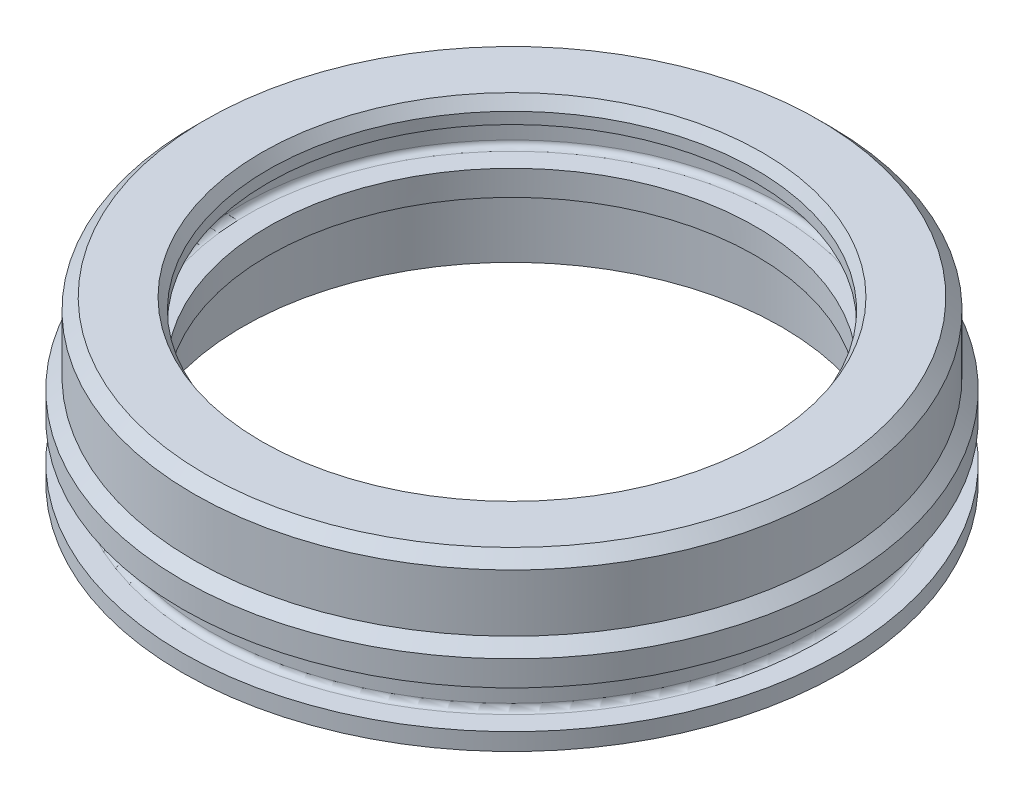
SolidWorks part; units mm, degrees
ref_plane "Face" through (0, 0, 0) normal (0, 0, 1) x (1, 0, 0)
ref_plane "Dessus" through (0, 0, 0) normal (0, 1, 0) x (1, 0, 0)
ref_plane "Droite" through (0, 0, 0) normal (1, 0, 0) x (0, 0, -1)
sketch "Esquisse1" plane through (0, 0, 0) normal (0, 0, 1) x (1, 0, 0)
  line L0 (0, 0) -> (-57.5, 0)
  line L1 (-57.5, 0) -> (-57.5, 14)
  line L2 (-57.5, 14) -> (-55.5, 16)
  line L3 (-55.5, 16) -> (-55.5, 28)
  line L4 (-55.5, 28) -> (0, 28)
  line L5 (0, 28) -> (0, 0)
  line L6 (0, 0) -> (0, -34.0519) construction
  dimension "D1" = 14
  dimension "D2" = 45
  dimension "D3" = 28
  dimension "D4" = 57.5
  dimension "D5" = 55.5
revolve "Révolution1" add sketch "Esquisse1" angle 360 about L6
chamfer "Chanfrein1" distance 2 angle 45 1 edges at (0, 28, 55.5)
sketch "Esquisse2" plane through (0, 28, 0) normal (0, 1, 0) x (-1, 0, 0)
  circle A0 centre (0, 0) radius 42.5
  circle A1 centre (0, 0) radius 55.5 construction
  dimension "D1" = 85
extrude "Enlèv. mat.-Extru.1" cut sketch "Esquisse2" against normal up to next
sketch "Esquisse3" plane through (0, 0, 0) normal (0, -1, 0) x (1, 0, 0)
  circle A0 centre (0, 0) radius 47
  circle A1 centre (0, 0) radius 57.5 construction
  dimension "D1" = 94
extrude "Enlèv. mat.-Extru.2" cut sketch "Esquisse3" against normal blind 13
sketch "Esquisse4" plane through (0, 0, 0) normal (0, 0, 1) x (1, 0, 0)
  line L0 (0, 0) -> (0, -11.8218) construction
  line L1 (-63.2419, 9.61) -> (-53.86, 9.61)
  line L2 (-63.2419, 9.61) -> (-63.2419, 3)
  line L3 (-63.2419, 3) -> (-53.86, 3)
  line L4 (-52.86, 8.61) -> (-52.86, 4)
  line L5 (-57.5, 0) -> (57.5, 0) construction
  arc A0 (-52.86, 4) -> (-53.86, 3) centre (-53.86, 4) cw
  arc A1 (-53.86, 9.61) -> (-52.86, 8.61) centre (-53.86, 8.61) cw
  dimension "D4" = 1
  dimension "D1" = 52.86
  dimension "D2" = 3
  dimension "D3" = 6.61
revolve "Enlèvement de matière-Révolution1" cut sketch "Esquisse4" angle 360 about L0
sketch "Esquisse5" plane through (0, 0, 0) normal (0, 0, 1) x (1, 0, 0)
  line L0 (0, 0) -> (0, -11.8218) construction
  line L1 (0, 24) -> (46.14, 24)
  line L2 (0, 24) -> (0, 17.39)
  line L3 (0, 17.39) -> (46.14, 17.39)
  line L4 (47.14, 23) -> (47.14, 18.39)
  line L5 (42.5, 28) -> (-42.5, 28) construction
  arc A0 (46.14, 24) -> (47.14, 23) centre (46.14, 23) cw
  arc A1 (47.14, 18.39) -> (46.14, 17.39) centre (46.14, 18.39) cw
  dimension "D4" = 1
  dimension "D1" = 47.14
  dimension "D2" = 6.61
  dimension "D3" = 4
revolve "Enlèvement de matière-Révolution2" cut sketch "Esquisse5" angle 360 about L0
chamfer "Chanfrein2" distance 2 angle 30 1 edges at (0, 28, 42.5)
sketch "Esquisse6" [suppressed] plane through (0, 0, 0) normal (0, 0, 1) x (1, 0, 0)
  line L1 (-61.2269, 33.566) -> (61.36, 33.566)
  line L2 (-61.2269, 33.566) -> (-61.2269, -6.0984)
  line L3 (-61.2269, -6.0984) -> (61.36, -6.0984)
  line L4 (61.36, 33.566) -> (61.36, -6.0984)
extrude "Coupe face" [suppressed] cut sketch "Esquisse6" along normal through all
